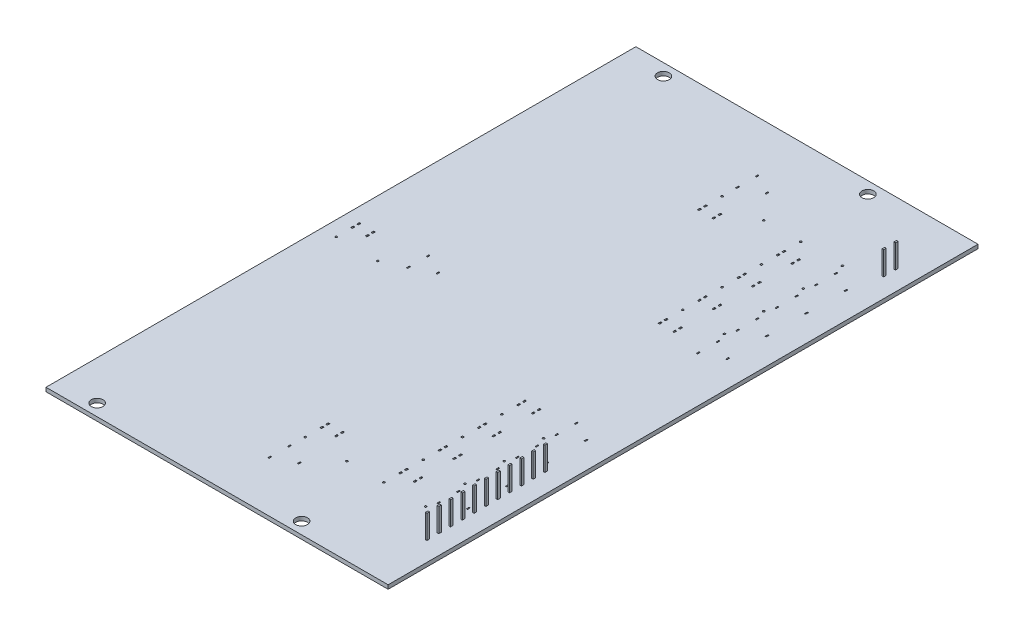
SolidWorks part; units mm, degrees
ref_plane "Front Plane" through (0, 0, 0) normal (0, 0, 1) x (1, 0, 0)
ref_plane "Top Plane" through (0, 0, 0) normal (0, 1, 0) x (1, 0, 0)
ref_plane "Right Plane" through (0, 0, 0) normal (1, 0, 0) x (0, 0, -1)
sketch "Sketch1" plane through (0, 0, 0) normal (0, 1, 0) x (1, 0, 0)
  line L1 (-25, -75) -> (25, -75)
  line L3 (-25, 75) -> (25, 75)
  line L4 (25, -75) -> (25, 75)
  line L5 (-25, -75) -> (25, 75) construction
  line L6 (-25, 75) -> (25, -75) construction
  line L7 (-25, -75) -> (-62, -75)
  line L9 (-25, 75) -> (-62, 75)
  line L10 (-62, -75) -> (-62, 75)
  point P0 (0, 0)
  dimension "D1" = 150
  dimension "D2" = 50
  dimension "D3" = 37
  dimension "D4" = 150
extrude "Boss-Extrude1" add sketch "Sketch1" along normal blind 1
sketch "Sketch3" plane through (0, 0, 0) normal (0, -1, 0) x (1, 0, 0)
  line L0 (25, 0) -> (-62, 0) construction
  line L1 (25, 75) -> (25, -75) construction
  line L2 (-62, -75) -> (-62, 75) construction
  line L3 (0, -75) -> (0, 75) construction
  line L4 (25, -75) -> (-62, -75) construction
  line L5 (-62, 75) -> (25, 75) construction
  line L6 (-62, -18) -> (25, -18) construction
  line L7 (1.7254, -16.925) -> (2.1254, -16.925)
  line L8 (1.7254, -16.925) -> (1.7254, -17.575)
  line L9 (1.7254, -17.575) -> (2.1254, -17.575)
  line L10 (2.1254, -16.925) -> (2.1254, -17.575)
  line L11 (1.7254, -16.925) -> (2.1254, -17.575) construction
  line L12 (1.7254, -17.575) -> (2.1254, -16.925) construction
  line L13 (3.7754, -75) -> (3.7754, 75) construction
  line L14 (5.8254, -16.925) -> (5.4254, -16.925)
  line L15 (5.4254, -16.925) -> (5.4254, -17.575)
  line L16 (5.8254, -17.575) -> (5.4254, -17.575)
  line L17 (5.8254, -16.925) -> (5.8254, -17.575)
  line L18 (5.8254, -19.075) -> (5.8254, -18.425)
  line L19 (5.8254, -19.075) -> (5.4254, -19.075)
  line L20 (5.4254, -19.075) -> (5.4254, -18.425)
  line L21 (5.8254, -18.425) -> (5.4254, -18.425)
  line L22 (2.1254, -19.075) -> (2.1254, -18.425)
  line L23 (1.7254, -19.075) -> (2.1254, -19.075)
  line L24 (1.7254, -19.075) -> (1.7254, -18.425)
  line L25 (1.7254, -18.425) -> (2.1254, -18.425)
  line L26 (5.8254, 16.925) -> (5.8254, 17.575)
  line L27 (5.8254, 16.925) -> (5.4254, 16.925)
  line L28 (5.4254, 16.925) -> (5.4254, 17.575)
  line L29 (5.8254, 17.575) -> (5.4254, 17.575)
  line L30 (2.1254, 16.925) -> (2.1254, 17.575)
  line L31 (1.7254, 16.925) -> (2.1254, 16.925)
  line L32 (1.7254, 16.925) -> (1.7254, 17.575)
  line L33 (1.7254, 17.575) -> (2.1254, 17.575)
  line L34 (5.8254, 18.425) -> (5.4254, 18.425)
  line L35 (5.8254, 19.075) -> (5.8254, 18.425)
  line L36 (5.8254, 19.075) -> (5.4254, 19.075)
  line L37 (5.4254, 19.075) -> (5.4254, 18.425)
  line L38 (1.7254, 18.425) -> (2.1254, 18.425)
  line L39 (2.1254, 19.075) -> (2.1254, 18.425)
  line L40 (1.7254, 19.075) -> (2.1254, 19.075)
  line L41 (1.7254, 19.075) -> (1.7254, 18.425)
  line L42 (-62, 26) -> (25, 26) construction
  line L43 (-62, -75) -> (-62, 75) construction
  line L44 (25, 75) -> (25, -75) construction
  line L45 (1.7254, 29.075) -> (2.1254, 29.075)
  line L46 (1.7254, 29.075) -> (1.7254, 28.425)
  line L47 (1.7254, 28.425) -> (2.1254, 28.425)
  line L48 (2.1254, 29.075) -> (2.1254, 28.425)
  line L49 (1.7254, 27.575) -> (2.1254, 27.575)
  line L50 (1.7254, 26.925) -> (1.7254, 27.575)
  line L51 (1.7254, 26.925) -> (2.1254, 26.925)
  line L52 (2.1254, 26.925) -> (2.1254, 27.575)
  line L53 (5.8254, 27.575) -> (5.4254, 27.575)
  line L54 (5.4254, 26.925) -> (5.4254, 27.575)
  line L55 (5.8254, 26.925) -> (5.4254, 26.925)
  line L56 (5.8254, 26.925) -> (5.8254, 27.575)
  line L57 (5.8254, 29.075) -> (5.4254, 29.075)
  line L58 (5.4254, 29.075) -> (5.4254, 28.425)
  line L59 (5.8254, 28.425) -> (5.4254, 28.425)
  line L60 (5.8254, 29.075) -> (5.8254, 28.425)
  line L61 (1.7254, 39.075) -> (2.1254, 39.075)
  line L62 (1.7254, 39.075) -> (1.7254, 38.425)
  line L63 (1.7254, 38.425) -> (2.1254, 38.425)
  line L64 (2.1254, 39.075) -> (2.1254, 38.425)
  line L65 (1.7254, 37.575) -> (2.1254, 37.575)
  line L66 (1.7254, 36.925) -> (1.7254, 37.575)
  line L67 (1.7254, 36.925) -> (2.1254, 36.925)
  line L68 (2.1254, 36.925) -> (2.1254, 37.575)
  line L69 (5.8254, 37.575) -> (5.4254, 37.575)
  line L70 (5.4254, 36.925) -> (5.4254, 37.575)
  line L71 (5.8254, 36.925) -> (5.4254, 36.925)
  line L72 (5.8254, 36.925) -> (5.8254, 37.575)
  line L73 (5.8254, 39.075) -> (5.4254, 39.075)
  line L74 (5.4254, 39.075) -> (5.4254, 38.425)
  line L75 (5.8254, 38.425) -> (5.4254, 38.425)
  line L76 (5.8254, 39.075) -> (5.8254, 38.425)
  line L77 (1.7254, 49.075) -> (2.1254, 49.075)
  line L78 (1.7254, 49.075) -> (1.7254, 48.425)
  line L79 (1.7254, 48.425) -> (2.1254, 48.425)
  line L80 (2.1254, 49.075) -> (2.1254, 48.425)
  line L81 (1.7254, 47.575) -> (2.1254, 47.575)
  line L82 (1.7254, 46.925) -> (1.7254, 47.575)
  line L83 (1.7254, 46.925) -> (2.1254, 46.925)
  line L84 (2.1254, 46.925) -> (2.1254, 47.575)
  line L85 (5.8254, 47.575) -> (5.4254, 47.575)
  line L86 (5.4254, 46.925) -> (5.4254, 47.575)
  line L87 (5.8254, 46.925) -> (5.4254, 46.925)
  line L88 (5.8254, 46.925) -> (5.8254, 47.575)
  line L89 (5.8254, 49.075) -> (5.4254, 49.075)
  line L90 (5.4254, 49.075) -> (5.4254, 48.425)
  line L91 (5.8254, 48.425) -> (5.4254, 48.425)
  line L92 (5.8254, 49.075) -> (5.8254, 48.425)
  line L93 (1.7254, -26.925) -> (2.1254, -26.925)
  line L94 (1.7254, -26.925) -> (1.7254, -27.575)
  line L95 (1.7254, -27.575) -> (2.1254, -27.575)
  line L96 (2.1254, -26.925) -> (2.1254, -27.575)
  line L97 (1.7254, -28.425) -> (2.1254, -28.425)
  line L98 (1.7254, -29.075) -> (1.7254, -28.425)
  line L99 (1.7254, -29.075) -> (2.1254, -29.075)
  line L100 (2.1254, -29.075) -> (2.1254, -28.425)
  line L101 (5.8254, -26.925) -> (5.4254, -26.925)
  line L102 (5.4254, -26.925) -> (5.4254, -27.575)
  line L103 (5.8254, -27.575) -> (5.4254, -27.575)
  line L104 (5.8254, -26.925) -> (5.8254, -27.575)
  line L105 (5.8254, -28.425) -> (5.4254, -28.425)
  line L106 (5.4254, -29.075) -> (5.4254, -28.425)
  line L107 (5.8254, -29.075) -> (5.4254, -29.075)
  line L108 (5.8254, -29.075) -> (5.8254, -28.425)
  line L109 (1.7254, -36.925) -> (2.1254, -36.925)
  line L110 (1.7254, -36.925) -> (1.7254, -37.575)
  line L111 (1.7254, -37.575) -> (2.1254, -37.575)
  line L112 (2.1254, -36.925) -> (2.1254, -37.575)
  line L113 (1.7254, -38.425) -> (2.1254, -38.425)
  line L114 (1.7254, -39.075) -> (1.7254, -38.425)
  line L115 (1.7254, -39.075) -> (2.1254, -39.075)
  line L116 (2.1254, -39.075) -> (2.1254, -38.425)
  line L117 (5.8254, -36.925) -> (5.4254, -36.925)
  line L118 (5.4254, -36.925) -> (5.4254, -37.575)
  line L119 (5.8254, -37.575) -> (5.4254, -37.575)
  line L120 (5.8254, -36.925) -> (5.8254, -37.575)
  line L121 (5.8254, -38.425) -> (5.4254, -38.425)
  line L122 (5.4254, -39.075) -> (5.4254, -38.425)
  line L123 (5.8254, -39.075) -> (5.4254, -39.075)
  line L124 (5.8254, -39.075) -> (5.8254, -38.425)
  line L125 (1.7254, -46.925) -> (2.1254, -46.925)
  line L126 (1.7254, -46.925) -> (1.7254, -47.575)
  line L127 (1.7254, -47.575) -> (2.1254, -47.575)
  line L128 (2.1254, -46.925) -> (2.1254, -47.575)
  line L129 (1.7254, -48.425) -> (2.1254, -48.425)
  line L130 (1.7254, -49.075) -> (1.7254, -48.425)
  line L131 (1.7254, -49.075) -> (2.1254, -49.075)
  line L132 (2.1254, -49.075) -> (2.1254, -48.425)
  line L133 (5.8254, -46.925) -> (5.4254, -46.925)
  line L134 (5.4254, -46.925) -> (5.4254, -47.575)
  line L135 (5.8254, -47.575) -> (5.4254, -47.575)
  line L136 (5.8254, -46.925) -> (5.8254, -47.575)
  line L137 (5.8254, -48.425) -> (5.4254, -48.425)
  line L138 (5.4254, -49.075) -> (5.4254, -48.425)
  line L139 (5.8254, -49.075) -> (5.4254, -49.075)
  line L140 (5.8254, -49.075) -> (5.8254, -48.425)
  line L141 (13.2172, 30.85) -> (13.5172, 30.85)
  line L142 (18.2172, 18.35) -> (18.5172, 18.35)
  line L143 (18.2172, 18.35) -> (18.2172, 17.65)
  line L144 (-18.2746, 47.575) -> (-17.8746, 47.575)
  line L145 (-18.2746, 46.925) -> (-18.2746, 47.575)
  line L146 (-18.2746, 46.925) -> (-17.8746, 46.925)
  line L147 (-17.8746, 46.925) -> (-17.8746, 47.575)
  line L148 (-18.2746, 49.075) -> (-17.8746, 49.075)
  line L149 (-18.2746, 49.075) -> (-18.2746, 48.425)
  line L150 (-18.2746, 48.425) -> (-17.8746, 48.425)
  line L151 (-17.8746, 49.075) -> (-17.8746, 48.425)
  line L152 (-14.1746, 47.575) -> (-14.5746, 47.575)
  line L153 (-14.5746, 46.925) -> (-14.5746, 47.575)
  line L154 (-14.1746, 46.925) -> (-14.5746, 46.925)
  line L155 (-14.1746, 46.925) -> (-14.1746, 47.575)
  line L156 (-14.1746, 49.075) -> (-14.5746, 49.075)
  line L157 (-14.5746, 49.075) -> (-14.5746, 48.425)
  line L158 (-14.1746, 48.425) -> (-14.5746, 48.425)
  line L159 (-14.1746, 49.075) -> (-14.1746, 48.425)
  line L160 (-18.2746, -48.425) -> (-17.8746, -48.425)
  line L161 (-18.2746, -49.075) -> (-18.2746, -48.425)
  line L162 (-18.2746, -49.075) -> (-17.8746, -49.075)
  line L163 (-17.8746, -49.075) -> (-17.8746, -48.425)
  line L164 (-18.2746, -46.925) -> (-17.8746, -46.925)
  line L165 (-18.2746, -46.925) -> (-18.2746, -47.575)
  line L166 (-18.2746, -47.575) -> (-17.8746, -47.575)
  line L167 (-17.8746, -46.925) -> (-17.8746, -47.575)
  line L168 (-14.1746, -46.925) -> (-14.5746, -46.925)
  line L169 (-14.5746, -46.925) -> (-14.5746, -47.575)
  line L170 (-14.1746, -47.575) -> (-14.5746, -47.575)
  line L171 (-14.1746, -46.925) -> (-14.1746, -47.575)
  line L172 (-14.1746, -48.425) -> (-14.5746, -48.425)
  line L173 (-14.5746, -49.075) -> (-14.5746, -48.425)
  line L174 (-14.1746, -49.075) -> (-14.5746, -49.075)
  line L175 (-14.1746, -49.075) -> (-14.1746, -48.425)
  line L176 (18.2172, 17.65) -> (18.5172, 17.65)
  line L177 (18.5172, 18.35) -> (18.5172, 17.65)
  line L178 (18.2172, 18.35) -> (18.5172, 17.65) construction
  line L179 (18.2172, 17.65) -> (18.5172, 18.35) construction
  line L180 (13.2172, 15.15) -> (13.5172, 15.15)
  line L181 (13.2172, 15.15) -> (13.2172, 15.85)
  line L182 (13.2172, 15.85) -> (13.5172, 15.85)
  line L183 (13.5172, 15.15) -> (13.5172, 15.85)
  line L184 (13.2172, 15.15) -> (13.5172, 15.85) construction
  line L185 (13.2172, 15.85) -> (13.5172, 15.15) construction
  line L186 (13.2172, 20.15) -> (13.5172, 20.15)
  line L187 (13.2172, 20.15) -> (13.2172, 20.85)
  line L188 (13.2172, 20.85) -> (13.5172, 20.85)
  line L189 (13.5172, 20.15) -> (13.5172, 20.85)
  line L190 (13.2172, 20.15) -> (13.5172, 20.85) construction
  line L191 (13.2172, 20.85) -> (13.5172, 20.15) construction
  line L192 (13.2172, 30.15) -> (13.2172, 30.85)
  line L193 (13.2172, 30.15) -> (13.5172, 30.15)
  line L194 (13.5172, 30.15) -> (13.5172, 30.85)
  line L195 (18.2172, 28.35) -> (18.5172, 28.35)
  line L196 (18.2172, 28.35) -> (18.2172, 27.65)
  line L197 (18.2172, 27.65) -> (18.5172, 27.65)
  line L198 (18.5172, 28.35) -> (18.5172, 27.65)
  line L199 (13.2172, 25.85) -> (13.5172, 25.85)
  line L200 (13.2172, 25.15) -> (13.2172, 25.85)
  line L201 (13.2172, 25.15) -> (13.5172, 25.15)
  line L202 (13.5172, 25.15) -> (13.5172, 25.85)
  line L203 (13.2172, 40.85) -> (13.5172, 40.85)
  line L204 (13.2172, 40.15) -> (13.2172, 40.85)
  line L205 (13.2172, 40.15) -> (13.5172, 40.15)
  line L206 (13.5172, 40.15) -> (13.5172, 40.85)
  line L207 (18.2172, 38.35) -> (18.5172, 38.35)
  line L208 (18.2172, 38.35) -> (18.2172, 37.65)
  line L209 (18.2172, 37.65) -> (18.5172, 37.65)
  line L210 (18.5172, 38.35) -> (18.5172, 37.65)
  line L211 (13.2172, 35.85) -> (13.5172, 35.85)
  line L212 (13.2172, 35.15) -> (13.2172, 35.85)
  line L213 (13.2172, 35.15) -> (13.5172, 35.15)
  line L214 (13.5172, 35.15) -> (13.5172, 35.85)
  line L215 (13.2172, 50.85) -> (13.5172, 50.85)
  line L216 (13.2172, 50.15) -> (13.2172, 50.85)
  line L217 (13.2172, 50.15) -> (13.5172, 50.15)
  line L218 (13.5172, 50.15) -> (13.5172, 50.85)
  line L219 (18.2172, 48.35) -> (18.5172, 48.35)
  line L220 (18.2172, 48.35) -> (18.2172, 47.65)
  line L221 (18.2172, 47.65) -> (18.5172, 47.65)
  line L222 (18.5172, 48.35) -> (18.5172, 47.65)
  line L223 (13.2172, 45.85) -> (13.5172, 45.85)
  line L224 (13.2172, 45.15) -> (13.2172, 45.85)
  line L225 (13.2172, 45.15) -> (13.5172, 45.15)
  line L226 (13.5172, 45.15) -> (13.5172, 45.85)
  line L227 (18.5172, -18.35) -> (18.5172, -17.65)
  line L228 (18.2172, -17.65) -> (18.5172, -17.65)
  line L229 (18.2172, -18.35) -> (18.2172, -17.65)
  line L230 (18.2172, -18.35) -> (18.5172, -18.35)
  line L231 (13.5172, -15.15) -> (13.5172, -15.85)
  line L232 (13.2172, -15.15) -> (13.5172, -15.15)
  line L233 (13.2172, -15.15) -> (13.2172, -15.85)
  line L234 (13.2172, -15.85) -> (13.5172, -15.85)
  line L235 (13.5172, -20.15) -> (13.5172, -20.85)
  line L236 (13.2172, -20.15) -> (13.5172, -20.15)
  line L237 (13.2172, -20.15) -> (13.2172, -20.85)
  line L238 (13.2172, -20.85) -> (13.5172, -20.85)
  line L239 (13.2172, -25.15) -> (13.5172, -25.15)
  line L240 (13.2172, -25.15) -> (13.2172, -25.85)
  line L241 (13.2172, -25.85) -> (13.5172, -25.85)
  line L242 (13.5172, -25.15) -> (13.5172, -25.85)
  line L243 (13.2172, -30.15) -> (13.5172, -30.15)
  line L244 (13.2172, -30.15) -> (13.2172, -30.85)
  line L245 (13.2172, -30.85) -> (13.5172, -30.85)
  line L246 (13.5172, -30.15) -> (13.5172, -30.85)
  line L247 (18.2172, -27.65) -> (18.5172, -27.65)
  line L248 (18.2172, -28.35) -> (18.2172, -27.65)
  line L249 (18.2172, -28.35) -> (18.5172, -28.35)
  line L250 (18.5172, -28.35) -> (18.5172, -27.65)
  line L251 (13.2172, -35.15) -> (13.5172, -35.15)
  line L252 (13.2172, -35.15) -> (13.2172, -35.85)
  line L253 (13.2172, -35.85) -> (13.5172, -35.85)
  line L254 (13.5172, -35.15) -> (13.5172, -35.85)
  line L255 (13.2172, -40.15) -> (13.5172, -40.15)
  line L256 (13.2172, -40.15) -> (13.2172, -40.85)
  line L257 (13.2172, -40.85) -> (13.5172, -40.85)
  line L258 (13.5172, -40.15) -> (13.5172, -40.85)
  line L259 (18.2172, -37.65) -> (18.5172, -37.65)
  line L260 (18.2172, -38.35) -> (18.2172, -37.65)
  line L261 (18.2172, -38.35) -> (18.5172, -38.35)
  line L262 (18.5172, -38.35) -> (18.5172, -37.65)
  line L263 (13.2172, -45.15) -> (13.5172, -45.15)
  line L264 (13.2172, -45.15) -> (13.2172, -45.85)
  line L265 (13.2172, -45.85) -> (13.5172, -45.85)
  line L266 (13.5172, -45.15) -> (13.5172, -45.85)
  line L267 (13.2172, -50.15) -> (13.5172, -50.15)
  line L268 (13.2172, -50.15) -> (13.2172, -50.85)
  line L269 (13.2172, -50.85) -> (13.5172, -50.85)
  line L270 (13.5172, -50.15) -> (13.5172, -50.85)
  line L271 (18.2172, -47.65) -> (18.5172, -47.65)
  line L272 (18.2172, -48.35) -> (18.2172, -47.65)
  line L273 (18.2172, -48.35) -> (18.5172, -48.35)
  line L274 (18.5172, -48.35) -> (18.5172, -47.65)
  line L275 (-18.2625, 62.3077) -> (-17.9625, 62.3077)
  line L276 (-18.2625, 61.6077) -> (-18.2625, 62.3077)
  line L277 (-18.2625, 61.6077) -> (-17.9625, 61.6077)
  line L278 (-17.9625, 61.6077) -> (-17.9625, 62.3077)
  line L279 (-18.2625, 57.3077) -> (-17.9625, 57.3077)
  line L280 (-18.2625, 56.6077) -> (-18.2625, 57.3077)
  line L281 (-18.2625, 56.6077) -> (-17.9625, 56.6077)
  line L282 (-17.9625, 56.6077) -> (-17.9625, 57.3077)
  line L283 (-13.2625, 59.8077) -> (-12.9625, 59.8077)
  line L284 (-13.2625, 59.8077) -> (-13.2625, 59.1077)
  line L285 (-13.2625, 59.1077) -> (-12.9625, 59.1077)
  line L286 (-12.9625, 59.8077) -> (-12.9625, 59.1077)
  line L287 (-18.2625, -56.6077) -> (-17.9625, -56.6077)
  line L288 (-18.2625, -56.6077) -> (-18.2625, -57.3077)
  line L289 (-18.2625, -57.3077) -> (-17.9625, -57.3077)
  line L290 (-17.9625, -56.6077) -> (-17.9625, -57.3077)
  line L291 (-18.2625, -61.6077) -> (-17.9625, -61.6077)
  line L292 (-18.2625, -61.6077) -> (-18.2625, -62.3077)
  line L293 (-18.2625, -62.3077) -> (-17.9625, -62.3077)
  line L294 (-17.9625, -61.6077) -> (-17.9625, -62.3077)
  line L295 (-13.2625, -59.1077) -> (-12.9625, -59.1077)
  line L296 (-13.2625, -59.8077) -> (-13.2625, -59.1077)
  line L297 (-13.2625, -59.8077) -> (-12.9625, -59.8077)
  line L298 (-12.9625, -59.8077) -> (-12.9625, -59.1077)
  circle A0 centre (1.9254, -23) radius 0.25
  circle A1 centre (12.5254, -23) radius 0.25
  circle A2 centre (1.9254, 33) radius 0.25
  circle A3 centre (12.5254, 33) radius 0.25
  circle A4 centre (1.9254, -33) radius 0.25
  circle A5 centre (12.5254, -33) radius 0.25
  circle A6 centre (1.9254, 23) radius 0.25
  circle A7 centre (12.5254, 23) radius 0.25
  circle A8 centre (1.9254, 43) radius 0.25
  circle A9 centre (12.5254, 43) radius 0.25
  circle A10 centre (1.9254, -43) radius 0.25
  circle A11 centre (12.5254, -43) radius 0.25
  circle A12 centre (-18.0746, -53) radius 0.25
  circle A13 centre (-7.4746, -53) radius 0.25
  circle A16 centre (1.9254, 53) radius 0.25
  circle A17 centre (12.5254, 53) radius 0.25
  circle A18 centre (-18.0746, 53) radius 0.25
  circle A19 centre (-7.4746, 53) radius 0.25
  circle A22 centre (1.9254, -53) radius 0.25
  circle A23 centre (12.5254, -53) radius 0.25
  point P10 (18.3672, 18)
  point P11 (5.6254, 27.25)
  point P20 (1.9254, -27.25)
  point P22 (5.6254, 17.25)
  point P26 (1.9254, -17.25)
  point P29 (1.9254, 27.25)
  point P38 (-18.0746, -47.25)
  point P41 (13.3672, 15.5)
  point P52 (5.6254, -17.25)
  point P57 (5.6254, -18.75)
  point P62 (1.9254, -18.75)
  point P68 (1.9254, 17.25)
  point P73 (5.6254, 18.75)
  point P74 (1.9254, 18.75)
  point P96 (5.6254, -27.25)
  point P99 (5.6254, 28.75)
  point P100 (1.9254, 28.75)
  point P113 (5.6254, 37.25)
  point P118 (1.9254, 37.25)
  point P123 (5.6254, 38.75)
  point P124 (1.9254, 38.75)
  point P137 (5.6254, 47.25)
  point P142 (1.9254, 47.25)
  point P147 (5.6254, 48.75)
  point P148 (1.9254, 48.75)
  point P163 (13.3672, 20.5)
  point P167 (-14.3746, 47.25)
  point P173 (5.6254, -28.75)
  point P178 (1.9254, -28.75)
  point P185 (1.9254, -37.25)
  point P192 (5.6254, -37.25)
  point P197 (5.6254, -38.75)
  point P202 (1.9254, -38.75)
  point P209 (1.9254, -47.25)
  point P216 (5.6254, -47.25)
  point P221 (5.6254, -48.75)
  point P226 (1.9254, -48.75)
  point P236 (-18.0746, 47.25)
  point P241 (-14.3746, 48.75)
  point P242 (-18.0746, 48.75)
  point P258 (-14.3746, -47.25)
  point P263 (-14.3746, -48.75)
  point P268 (-18.0746, -48.75)
  point P278 (18.3672, -18)
  point P280 (18.3672, 28)
  point P285 (13.3672, 25.5)
  point P290 (13.3672, 30.5)
  point P295 (18.3672, 38)
  point P300 (13.3672, 35.5)
  point P305 (13.3672, 40.5)
  point P310 (18.3672, 48)
  point P315 (13.3672, 45.5)
  point P320 (13.3672, 50.5)
  point P328 (13.3672, -15.5)
  point P333 (13.3672, -20.5)
  point P340 (18.3672, -28)
  point P345 (13.3672, -25.5)
  point P350 (13.3672, -30.5)
  point P355 (18.3672, -38)
  point P360 (13.3672, -35.5)
  point P365 (13.3672, -40.5)
  point P370 (18.3672, -48)
  point P375 (13.3672, -45.5)
  point P380 (13.3672, -50.5)
  point P385 (-13.1125, 59.4577)
  point P390 (-18.1125, 56.9577)
  point P395 (-18.1125, 61.9577)
  point P400 (-13.1125, -59.4577)
  point P405 (-18.1125, -56.9577)
  point P410 (-18.1125, -61.9577)
  dimension "D1" = 17.25
  dimension "D2" = 0.65
  dimension "D3" = 0.4
  dimension "D4" = 18
  dimension "D6" = 0.5
  dimension "D8" = 1.85
  dimension "D9" = 0.5
  dimension "D11" = 0.5
  dimension "D12" = 0.5
  dimension "D5" = 1.85
  dimension "D7" = 23
  dimension "D10" = 10.6
  dimension "D13" = 23
  dimension "D14" = 23
  dimension "D15" = 10.6
  dimension "D16" = 26
  dimension "D19" = 18
  dimension "D20" = 0.3
  dimension "D21" = 0.7
  dimension "D22" = 0.3
  dimension "D23" = 0.7
  dimension "D24" = 0.3
  dimension "D25" = 0.7
  dimension "D26" = 2.5
  dimension "D27" = 5
  dimension "D28" = 5
  dimension "D29" = 5
  dimension "D30" = 4
  dimension "D34" = 2
  dimension "D36" = 21.2246
  dimension "D37" = 11.6328
  dimension "D38" = 23.0746
  dimension "D18" = 4
  dimension "D17" = 4
  dimension "D35" = 2
  dimension "D31" = 4
  dimension "D32" = 2
  dimension "D33" = 2
extrude "Cut-Extrude1" cut sketch "Sketch3" against normal blind 1
sketch "Sketch6" plane through (0, 1, 0) normal (0, 1, 0) x (1, 0, 0)
  line L0 (-62, 0) -> (25, 0) construction
  line L1 (-62, 75) -> (-62, -75) construction
  line L2 (25, -75) -> (25, 75) construction
  line L3 (0, 75) -> (0, -75) construction
  line L4 (25, 75) -> (-62, 75) construction
  line L5 (-62, -75) -> (25, -75) construction
  line L6 (-54.3246, -0.425) -> (-54.3246, -1.075)
  line L7 (-58.4246, 0.425) -> (-58.0246, 0.425)
  line L8 (-58.4246, 0.425) -> (-58.4246, 1.075)
  line L9 (-58.4246, 1.075) -> (-58.0246, 1.075)
  line L10 (-58.0246, 0.425) -> (-58.0246, 1.075)
  line L11 (-58.4246, 0.425) -> (-58.0246, 1.075) construction
  line L12 (-58.4246, 1.075) -> (-58.0246, 0.425) construction
  line L13 (-54.7246, 0.425) -> (-54.3246, 0.425)
  line L14 (-54.7246, 0.425) -> (-54.7246, 1.075)
  line L15 (-54.7246, 1.075) -> (-54.3246, 1.075)
  line L16 (-54.3246, 0.425) -> (-54.3246, 1.075)
  line L17 (-54.7246, 0.425) -> (-54.3246, 1.075) construction
  line L18 (-54.7246, 1.075) -> (-54.3246, 0.425) construction
  line L19 (-54.7246, -1.075) -> (-54.3246, -1.075)
  line L20 (-54.7246, -0.425) -> (-54.7246, -1.075)
  line L21 (-54.7246, -0.425) -> (-54.3246, -0.425)
  line L22 (-58.0246, -0.425) -> (-58.0246, -1.075)
  line L23 (-58.4246, -1.075) -> (-58.0246, -1.075)
  line L24 (-58.4246, -0.425) -> (-58.4246, -1.075)
  line L25 (-58.4246, -0.425) -> (-58.0246, -0.425)
  line L27 (-37.4783, 0.35) -> (-37.1783, 0.35)
  line L28 (-37.4783, 0.35) -> (-37.4783, -0.35)
  line L29 (-37.4783, -0.35) -> (-37.1783, -0.35)
  line L30 (-37.1783, 0.35) -> (-37.1783, -0.35)
  line L31 (-37.4783, 0.35) -> (-37.1783, -0.35) construction
  line L32 (-37.4783, -0.35) -> (-37.1783, 0.35) construction
  line L33 (-42.4783, -2.15) -> (-42.1783, -2.15)
  line L34 (-42.4783, -2.15) -> (-42.4783, -2.85)
  line L35 (-42.4783, -2.85) -> (-42.1783, -2.85)
  line L36 (-42.1783, -2.15) -> (-42.1783, -2.85)
  line L37 (-42.4783, -2.15) -> (-42.1783, -2.85) construction
  line L38 (-42.4783, -2.85) -> (-42.1783, -2.15) construction
  line L39 (-42.4783, 2.15) -> (-42.1783, 2.15)
  line L40 (-42.4783, 2.15) -> (-42.4783, 2.85)
  line L41 (-42.4783, 2.85) -> (-42.1783, 2.85)
  line L42 (-42.1783, 2.15) -> (-42.1783, 2.85)
  line L43 (-42.4783, 2.15) -> (-42.1783, 2.85) construction
  line L44 (-42.4783, 2.85) -> (-42.1783, 2.15) construction
  line L45 (25, -75) -> (25, 75) construction
  circle A0 centre (-58.2135, -5) radius 0.25
  circle A1 centre (-47.6135, -5) radius 0.25
  point P13 (-54.5246, -0.75)
  point P17 (-58.2246, 0.75)
  point P22 (-54.5246, 0.75)
  point P28 (-58.2246, -0.75)
  point P37 (-37.3283, 0)
  point P42 (-42.3283, -2.5)
  point P47 (-42.3283, 2.5)
  point P52 (0, 0)
  point P53 (0, 0)
  point P54 (0, 0)
  point P55 (0, 0)
  dimension "D1" = 0.4
  dimension "D2" = 0.65
  dimension "D8" = 0.5
  dimension "D9" = 0.5
  dimension "D3" = 0.4
  dimension "D4" = 0.65
  dimension "D5" = 0
  dimension "D6" = 0.75
  dimension "D7" = 3.7
  dimension "D10" = 10.6
  dimension "D11" = 5
  dimension "D12" = 0.3
  dimension "D13" = 0.7
  dimension "D14" = 0.3
  dimension "D15" = 0.7
  dimension "D16" = 0.3
  dimension "D17" = 0.7
  dimension "D18" = 2.5
  dimension "D19" = 5
  dimension "D20" = 5
  dimension "D21" = 5
  dimension "D22" = 83.2246
extrude "Cut-Extrude3" cut sketch "Sketch6" against normal blind 1
sketch "Sketch7" plane through (0, 1, 0) normal (0, 1, 0) x (1, 0, 0)
  line L0 (25, -75) -> (25, 75) construction
  line L1 (25, 75) -> (-62, 75) construction
  line L2 (-62, -75) -> (25, -75) construction
  circle A0 centre (0, 72) radius 1.5
  circle A1 centre (0, -72) radius 1.5
  circle A2 centre (-52, 72) radius 1.5
  circle A3 centre (-52, -72) radius 1.5
  dimension "D1" = 3
  dimension "D2" = 3
  dimension "D3" = 3
  dimension "D4" = 3
  dimension "D5" = 25
  dimension "D6" = 3
  dimension "D7" = 3
  dimension "D8" = 3
  dimension "D9" = 25
  dimension "D10" = 3
  dimension "D11" = 77
  dimension "D12" = 77
extrude "Cut-Extrude4" cut sketch "Sketch7" against normal blind 1
sketch "Sketch9" plane through (0, 0, 0) normal (0, -1, 0) x (1, 0, 0)
  line L0 (19.8, 57.325) -> (20.2, 57.325)
  line L1 (19.8, 59.675) -> (20.2, 59.675)
  line L2 (19.8, 59.675) -> (19.8, 60.325)
  line L3 (19.8, 60.325) -> (20.2, 60.325)
  line L4 (20.2, 59.675) -> (20.2, 60.325)
  line L5 (19.8, 59.675) -> (20.2, 60.325) construction
  line L6 (19.8, 60.325) -> (20.2, 59.675) construction
  line L7 (19.8, 56.675) -> (19.8, 57.325)
  line L8 (19.8, 56.675) -> (20.2, 56.675)
  line L9 (20.2, 56.675) -> (20.2, 57.325)
  line L10 (19.8, 54.325) -> (20.2, 54.325)
  line L11 (19.8, 53.675) -> (19.8, 54.325)
  line L12 (19.8, 53.675) -> (20.2, 53.675)
  line L13 (20.2, 53.675) -> (20.2, 54.325)
  line L14 (19.8, 51.325) -> (20.2, 51.325)
  line L15 (19.8, 50.675) -> (19.8, 51.325)
  line L16 (19.8, 50.675) -> (20.2, 50.675)
  line L17 (20.2, 50.675) -> (20.2, 51.325)
  line L18 (19.8, 48.325) -> (20.2, 48.325)
  line L19 (19.8, 47.675) -> (19.8, 48.325)
  line L20 (19.8, 47.675) -> (20.2, 47.675)
  line L21 (20.2, 47.675) -> (20.2, 48.325)
  line L22 (19.8, 45.325) -> (20.2, 45.325)
  line L23 (19.8, 44.675) -> (19.8, 45.325)
  line L24 (19.8, 44.675) -> (20.2, 44.675)
  line L25 (20.2, 44.675) -> (20.2, 45.325)
  line L26 (19.8, 42.325) -> (20.2, 42.325)
  line L27 (19.8, 41.675) -> (19.8, 42.325)
  line L28 (19.8, 41.675) -> (20.2, 41.675)
  line L29 (20.2, 41.675) -> (20.2, 42.325)
  line L30 (19.8, 39.325) -> (20.2, 39.325)
  line L31 (19.8, 38.675) -> (19.8, 39.325)
  line L32 (19.8, 38.675) -> (20.2, 38.675)
  line L33 (20.2, 38.675) -> (20.2, 39.325)
  line L34 (19.8, 36.325) -> (20.2, 36.325)
  line L35 (19.8, 35.675) -> (19.8, 36.325)
  line L36 (19.8, 35.675) -> (20.2, 35.675)
  line L37 (20.2, 35.675) -> (20.2, 36.325)
  line L38 (19.8, 33.325) -> (20.2, 33.325)
  line L39 (19.8, 32.675) -> (19.8, 33.325)
  line L40 (19.8, 32.675) -> (20.2, 32.675)
  line L41 (20.2, 32.675) -> (20.2, 33.325)
  line L42 (19.8, 30.325) -> (20.2, 30.325)
  line L43 (19.8, 29.675) -> (19.8, 30.325)
  line L44 (19.8, 29.675) -> (20.2, 29.675)
  line L45 (20.2, 29.675) -> (20.2, 30.325)
  line L47 (19.8, -56.4529) -> (20.2, -56.4529)
  line L48 (19.8, -56.4529) -> (19.8, -55.8029)
  line L49 (19.8, -55.8029) -> (20.2, -55.8029)
  line L50 (20.2, -56.4529) -> (20.2, -55.8029)
  line L51 (19.8, -56.4529) -> (20.2, -55.8029) construction
  line L52 (19.8, -55.8029) -> (20.2, -56.4529) construction
  line L53 (19.8, -59.4529) -> (20.2, -59.4529)
  line L54 (19.8, -59.4529) -> (19.8, -58.8029)
  line L55 (19.8, -58.8029) -> (20.2, -58.8029)
  line L56 (20.2, -59.4529) -> (20.2, -58.8029)
  line L57 (19.8, -59.4529) -> (20.2, -58.8029) construction
  line L58 (19.8, -58.8029) -> (20.2, -59.4529) construction
  point P0 (20, 60)
  point P5 (20, -56.1279)
  point P8 (20, 57)
  point P13 (20, 54)
  point P18 (20, 51)
  point P23 (20, 48)
  point P28 (20, 45)
  point P33 (20, 42)
  point P38 (20, 39)
  point P43 (20, 36)
  point P48 (20, 33)
  point P53 (20, 30)
  point P61 (20, -59.1279)
  dimension "D1" = 0.4
  dimension "D2" = 0.65
  dimension "D3" = 20
  dimension "D4" = 60
  dimension "D6" = 0.65
  dimension "D7" = 0.4
  dimension "D8" = 0.65
  dimension "D9" = 0.4
  dimension "D10" = 20
  dimension "D11" = 20
  dimension "D12" = 3
  dimension "D13" = 3
  dimension "D5" = 11
extrude "Boss-Extrude2" add sketch "Sketch9" against normal blind 7
